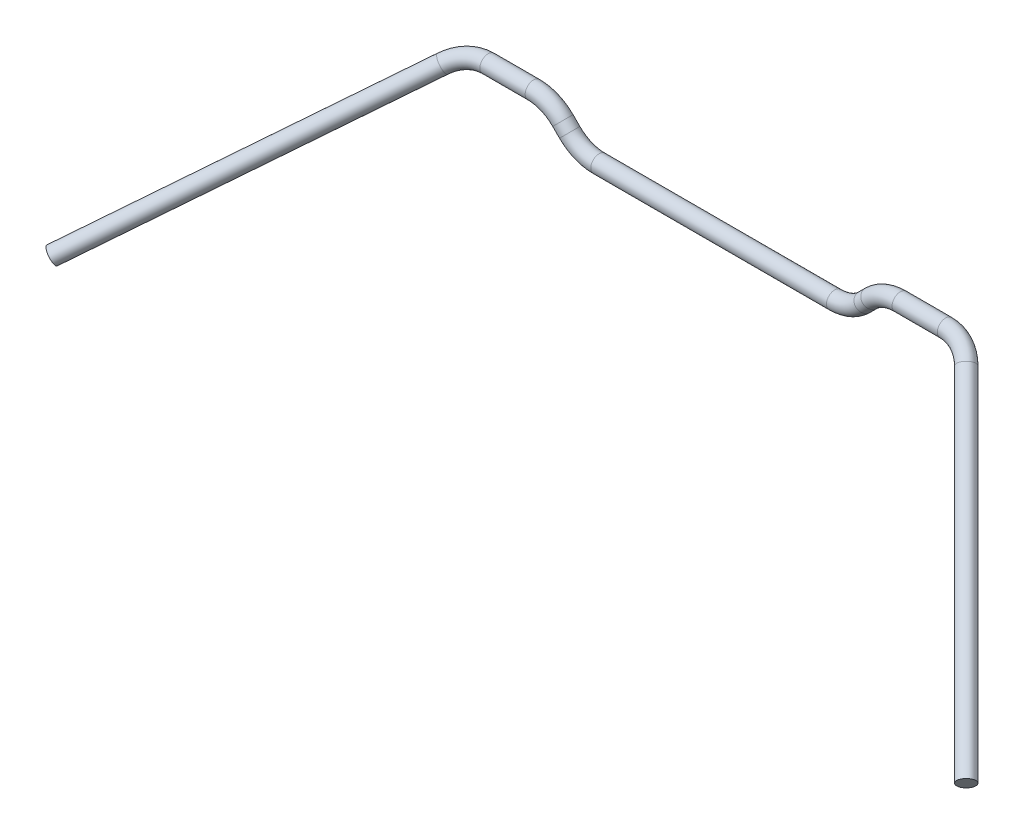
SolidWorks part; units mm, degrees
ref_plane "Face" through (0, 0, 0) normal (0, 0, 1) x (1, 0, 0)
ref_plane "Dessus" through (0, 0, 0) normal (0, 1, 0) x (1, 0, 0)
ref_plane "Droite" through (0, 0, 0) normal (1, 0, 0) x (0, 0, -1)
sketch3d "Esquisse3D1"
  line L0 (0, 0, 0) -> (5.6716, 0, 0)
  line L1 (7.0858, 0.5858, 0) -> (7.4142, 0.9142, 0)
  line L2 (8.8284, 1.5, 0) -> (11.0095, 1.5, 0)
  line L3 (6.5, 0, 0) -> (8, 0, 0) construction
  line L4 (8, 1.5, 0) -> (8, 0, 0) construction
  line L5 (12.6003, 0.9897, 0.6003) -> (22, -7, 10)
  line L6 (12, 1.5, 0) -> (20.7812, 1.5, 0) construction
  line L7 (12, 1.5, 0) -> (12, -9.2574, 0) construction
  arc A0 (7.0858, 0.5858, 0) -> (5.6716, 0, 0) centre (5.6716, 2, 0) ccw
  arc A1 (8.8284, 1.5, 0) -> (7.4142, 0.9142, 0) centre (8.8284, -0.5, 0) ccw
  arc A2 (12.6003, 0.9897, 0.6003) -> (11.0095, 1.5, 0) centre (11.0095, 0.2047, 1.5239) ccw
  point P11 (6.5, 0, 0)
  point P13 (5.6716, 2, -2)
  point P16 (8, 1.5, 0)
  point P18 (8.8284, -0.5, 2)
  point P21 (12, 1.5, 0)
  point P23 (11.0095, 1.7286, 2.8192)
  dimension "D8" = 2
  dimension "D9" = 2
  dimension "D1" = 6.5
  dimension "D2" = 1.5
  dimension "D3" = 45
  dimension "D4" = 4
  dimension "D5" = 22
  dimension "D7" = 16.5
  dimension "D6" = 10
sketch "Esquisse2" plane through (0, 0, 0) normal (1, 0, 0) x (0, 0, -1)
  circle A0 centre (0, 0) radius 0.4
  dimension "D1" = 0.8
sweep "Balayage1" add profiles "Esquisse2" path "Esquisse3D1"
mirror "Symétrie1" about plane through (0, 0, 0) normal (1, 0, 0) of "Balayage1"
